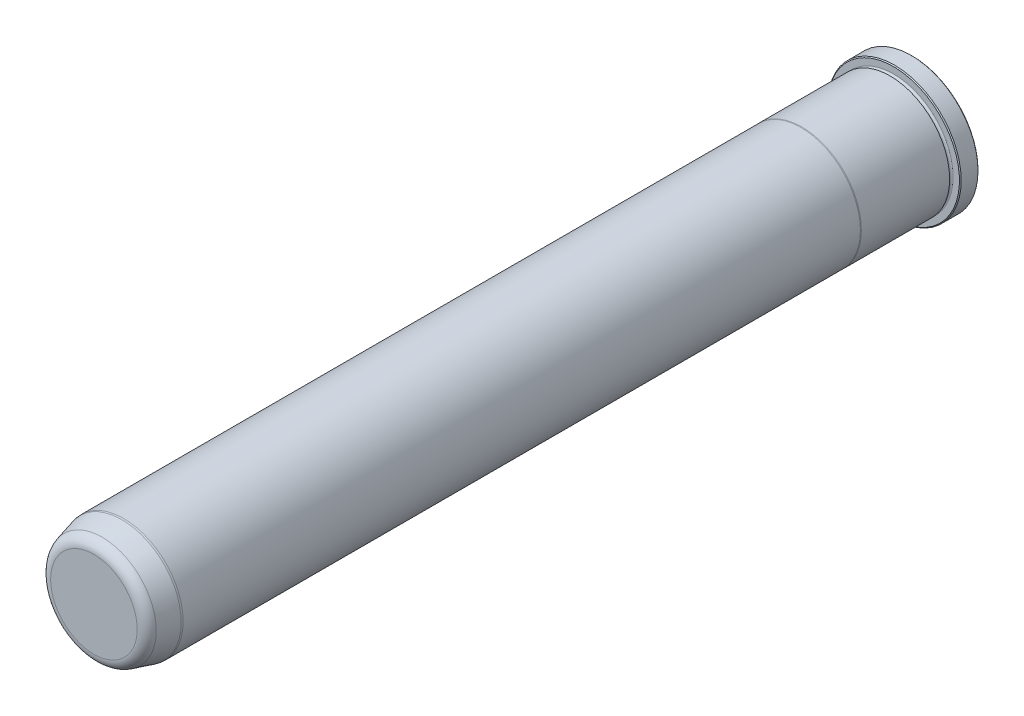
SolidWorks part; units mm, degrees
ref_plane "Front Plane" through (0, 0, 0) normal (0, 0, 1) x (1, 0, 0)
ref_plane "Top Plane" through (0, 0, 0) normal (0, 1, 0) x (1, 0, 0)
ref_plane "Right Plane" through (0, 0, 0) normal (1, 0, 0) x (0, 0, -1)
sketch "Sketch1" plane through (0, 0, 0) normal (1, 0, 0) x (0, 0, -1)
  line L0 (0, 0) -> (0, 28.448)
  line L1 (0, 28.448) -> (-7.9248, 28.448)
  line L2 (-7.9248, 28.448) -> (-7.9248, 25.3873)
  line L3 (-7.9248, 24.6253) -> (-9.4488, 24.6253) construction
  line L4 (-9.4488, 25.3873) -> (-9.4488, 25.4127)
  line L5 (-9.4488, 25.4127) -> (-47.1348, 25.4127)
  line L6 (-47.1348, 25.4127) -> (-47.498, 25.3873)
  line L7 (-47.498, 25.3873) -> (-336.55, 25.3873)
  line L9 (-349.25, 22.1219) -> (-349.25, 0)
  line L10 (-349.25, 0) -> (0, 0)
  line L11 (0, 0) -> (13.6287, 0) construction
  line L12 (-336.55, 25.3873) -> (-337.312, 25.3206)
  line L13 (-337.312, 25.3206) -> (-349.25, 22.1219)
  arc A0 (-9.4488, 25.3873) -> (-7.9248, 25.3873) centre (-8.6868, 25.3873) ccw
  dimension "D14" = 1.524
  dimension "D1" = 7.9248
  dimension "D2" = 1.524
  dimension "D3" = 56.896
  dimension "D4" = 50.8254
  dimension "D5" = 47.498
  dimension "D6" = 349.25
  dimension "D7" = 0.7874
  dimension "D8" = 4
  dimension "D9" = 50.7746
  dimension "D10" = 5
  dimension "D11" = 15
  dimension "D12" = 0.762
  dimension "D13" = 12.7
revolve "Revolve1" add sketch "Sketch1" angle 360 about L11
fillet "Fillet6" radius 4.7625 1 edges at (22.1219, 0, 349.25)
chamfer "Chamfer1" distance 0.381 angle 45 2 edges at (28.448, 0, 0) (28.448, 0, 7.9248)
